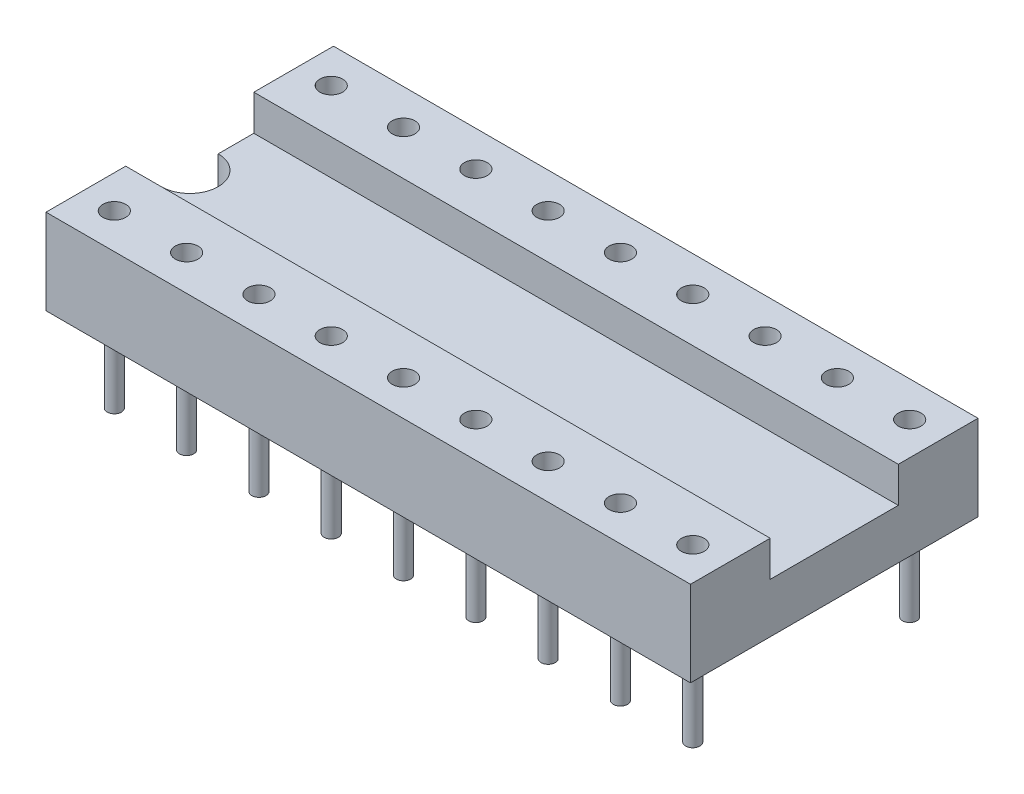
SolidWorks part; units mm, degrees
ref_plane "Plan de face" through (0, 0, 0) normal (0, 0, 1) x (1, 0, 0)
ref_plane "Plan de dessus" through (0, 0, 0) normal (0, 1, 0) x (1, 0, 0)
ref_plane "Plan de droite" through (0, 0, 0) normal (1, 0, 0) x (0, 0, -1)
sketch "Esquisse1" plane through (0, 0, 0) normal (1, 0, 0) x (0, 0, -1)
  line L0 (12.2051, 0) -> (-23.3437, 0) construction
  line L1 (0, -4.6214) -> (0, 25.9507) construction
  line L2 (-5.7968, 1.75) -> (2.763, 1.75) construction
  line L3 (5.7565, 3) -> (-6.8307, 3) construction
  line L4 (5.05, 3.8077) -> (5.05, -1.0493) construction
  line L5 (-5.05, 3.7235) -> (-5.05, -1.0493) construction
  line L6 (-2.25, 3.5071) -> (-2.25, 0.8142) construction
  line L7 (2.25, 3.5071) -> (2.25, 0.8142) construction
  line L8 (-2.25, 1.75) -> (-2.25, 3)
  line L9 (-2.25, 3) -> (-5.05, 3)
  line L10 (-5.05, 3) -> (-5.05, 0)
  line L11 (-5.05, 0) -> (5.05, 0)
  line L12 (5.05, 0) -> (5.05, 3)
  line L13 (5.05, 3) -> (2.25, 3)
  line L14 (2.25, 3) -> (2.25, 1.75)
  line L15 (2.25, 1.75) -> (-2.25, 1.75)
  dimension "D1" = 1.75
  dimension "D2" = 3
  dimension "D3" = 5.05
  dimension "D4" = 5.05
  dimension "D5" = 2.8
  dimension "D6" = 2.8
extrude "Extrusion1" add sketch "Esquisse1" along normal blind 22.64
sketch "Esquisse2" plane through (0, 1.75, 0) normal (0, 1, 0) x (-1, 0, 0)
  line L0 (0, -1) -> (0, 1)
  arc A0 (0, 1) -> (0, -1) centre (0, 0) ccw
extrude "Enlèv. mat.-Extru.1" cut sketch "Esquisse2" against normal through all
sketch "Esquisse3" plane through (0, 3, 0) normal (0, 1, 0) x (-1, 0, 0)
  line L0 (-13.1576, 5.05) -> (2.3638, 5.05) construction
  line L1 (0, 6.1465) -> (0, -6.3771) construction
  line L2 (1.5124, 0) -> (-12.9979, 0) construction
  line L3 (1.0512, 3.81) -> (-15.6055, 3.81) construction
  line L4 (-1.16, 6.2884) -> (-1.16, 1.7827) construction
  circle A0 centre (-1.16, 3.81) radius 0.4
  circle A1 centre (-1.16, -3.81) radius 0.4
  circle A2 centre (-3.7, 3.81) radius 0.4
  circle A3 centre (-3.7, -3.81) radius 0.4
  circle A4 centre (-6.24, 3.81) radius 0.4
  circle A5 centre (-6.24, -3.81) radius 0.4
  circle A6 centre (-8.78, 3.81) radius 0.4
  circle A7 centre (-8.78, -3.81) radius 0.4
  circle A8 centre (-11.32, 3.81) radius 0.4
  circle A9 centre (-11.32, -3.81) radius 0.4
  circle A10 centre (-13.86, 3.81) radius 0.4
  circle A11 centre (-13.86, -3.81) radius 0.4
  circle A12 centre (-16.4, 3.81) radius 0.4
  circle A13 centre (-16.4, -3.81) radius 0.4
  circle A14 centre (-18.94, 3.81) radius 0.4
  circle A15 centre (-18.94, -3.81) radius 0.4
  circle A16 centre (-21.48, 3.81) radius 0.4
  circle A17 centre (-21.48, -3.81) radius 0.4
  dimension "D1" = 1.24
  dimension "D2" = 1.16
extrude "Enlèv. mat.-Extru.2" cut sketch "Esquisse3" against normal blind 2.5
sketch "Esquisse5" plane through (0, 0, 0) normal (0, -1, 0) x (1, 0, 0)
  line L0 (-0.4263, 0) -> (10.6481, 0) construction
  circle A0 centre (1.16, 3.81) radius 0.25
  circle A1 centre (1.16, -3.81) radius 0.25
  circle A2 centre (3.7, -3.81) radius 0.25
  circle A3 centre (3.7, 3.81) radius 0.25
  circle A4 centre (6.24, -3.81) radius 0.25
  circle A5 centre (6.24, 3.81) radius 0.25
  circle A6 centre (8.78, -3.81) radius 0.25
  circle A7 centre (8.78, 3.81) radius 0.25
  circle A8 centre (11.32, -3.81) radius 0.25
  circle A9 centre (11.32, 3.81) radius 0.25
  circle A10 centre (13.86, -3.81) radius 0.25
  circle A11 centre (13.86, 3.81) radius 0.25
  circle A12 centre (16.4, -3.81) radius 0.25
  circle A13 centre (16.4, 3.81) radius 0.25
  circle A14 centre (18.94, -3.81) radius 0.25
  circle A15 centre (18.94, 3.81) radius 0.25
  circle A16 centre (21.48, -3.81) radius 0.25
  circle A17 centre (21.48, 3.81) radius 0.25
  dimension "D1" = 3.81
extrude "Extrusion2" add sketch "Esquisse5" along normal blind 3
